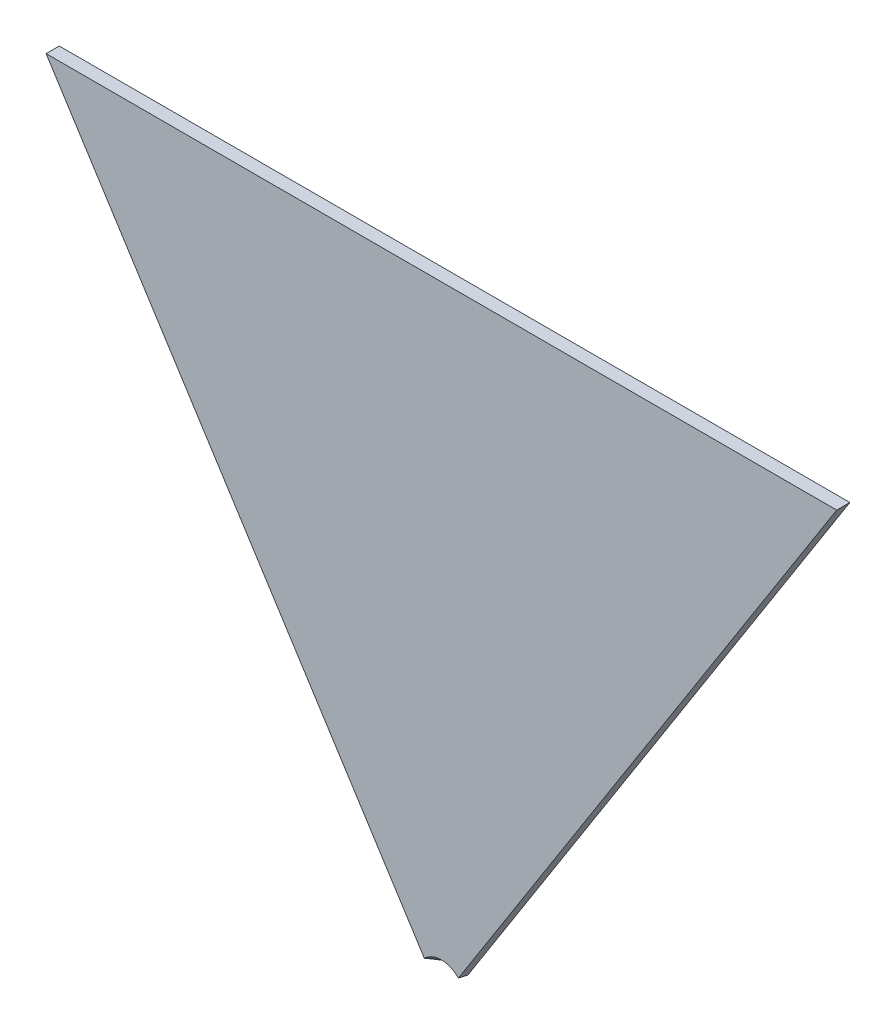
SolidWorks part; units mm, degrees
ref_plane "Ebene vorne" through (0, 0, 0) normal (0, 0, 1) x (1, 0, 0)
ref_plane "Ebene oben" through (0, 0, 0) normal (0, 1, 0) x (1, 0, 0)
ref_plane "Ebene rechts" through (0, 0, 0) normal (1, 0, 0) x (0, 0, -1)
sketch "Skizze1" plane through (0, 0, 0) normal (0, 0, 1) x (1, 0, 0)
  line L0 (-284.0662, 9.706) -> (165.9338, -697.354)
  line L1 (165.9338, -697.354) -> (615.9338, 9.706)
  line L2 (165.9338, -82.1462) -> (165.9338, 49917.8538) construction
  line L3 (-284.0662, 9.706) -> (49715.9338, 9.706) construction
  line L4 (-284.0662, 9.706) -> (615.9338, 9.706)
  dimension "D1" = 450
  dimension "D2" = 450
  dimension "D3" = 707.06
extrude "Aufsatz-Linear austragen1" add sketch "Skizze1" along normal blind 15
sketch "Skizze2" plane through (1026.6965, -448.4314, 341.5398) normal (0, 0.5804, 0.8143) x (0, 0.8143, -0.5804)
  circle A0 centre (-13.1754, 860.7627) radius 31.5
extrude "Schnitt-Linear austragen1" cut sketch "Skizze2" against normal through all
